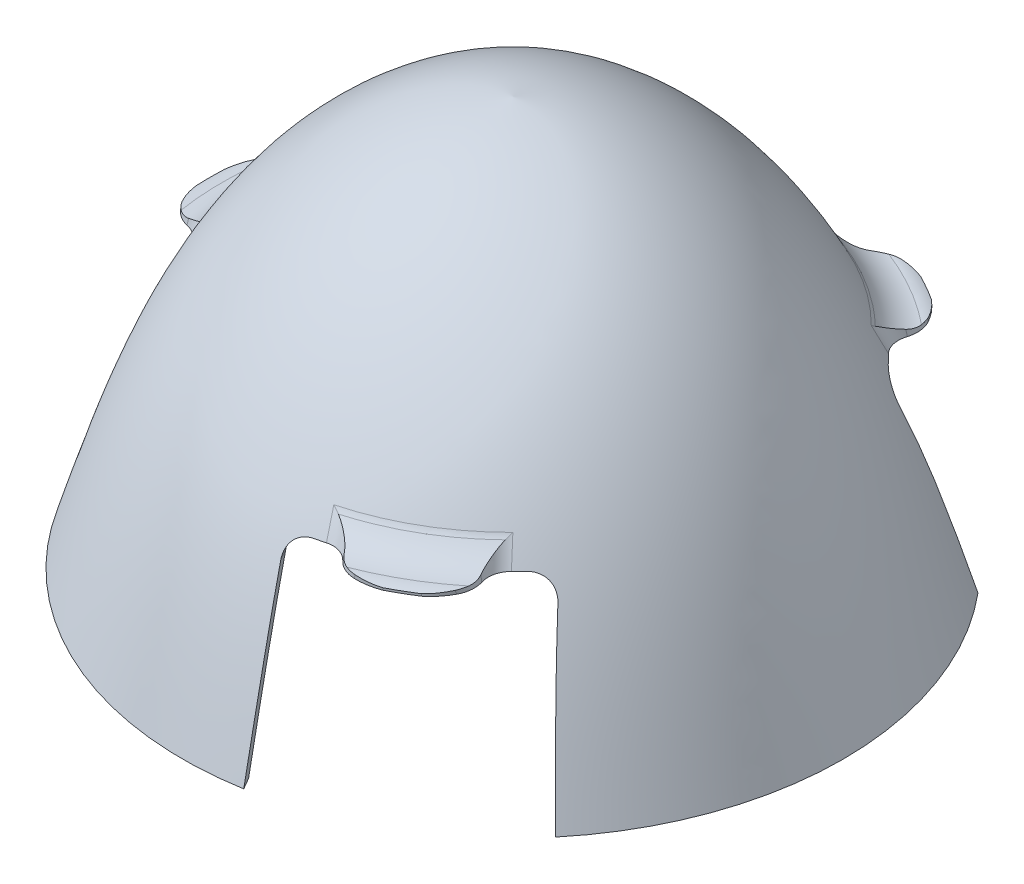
SolidWorks part; units mm, degrees
ref_plane "Face" through (0, 0, 0) normal (0, 0, 1) x (1, 0, 0)
ref_plane "Dessus" through (0, 0, 0) normal (0, 1, 0) x (1, 0, 0)
ref_plane "Droite" through (0, 0, 0) normal (1, 0, 0) x (0, 0, -1)
sketch "Esquisse1" plane through (0, 0, 0) normal (0, 0, 1) x (1, 0, 0)
  line L0 (0, 96.7594) -> (0, -88.7439) construction
  line L1 (-69.5, -71.5676) -> (0, -71.5676)
  line L2 (0, -71.5676) -> (0, 14.4324)
  point P6 (-48.9523, -19.4664)
  point P7 (-7.616, 13.2048)
  point P10 (-36.4902, -3.4927)
  dimension "D1" = 139
  dimension "D2" = 86
revolve "Révolution1" add sketch "Esquisse1" angle 360 about L0
shell "Coque1" thickness 2.5
sketch "Esquisse2" plane through (0, 0, 0) normal (1, 0, 0) x (0, 0, -1)
  line L0 (0, 0) -> (0, -78.7304) construction
  line L1 (-21.3551, -37.1841) -> (-24, -71.5676)
  line L2 (-16.3698, -32.5676) -> (16.3698, -32.5676)
  line L3 (-69.5, -71.5676) -> (69.5, -71.5676) construction
  line L4 (-24, -71.5676) -> (24, -71.5676)
  line L5 (21.3551, -37.1841) -> (24, -71.5676)
  arc A0 (-21.3551, -37.1841) -> (-16.3698, -32.5676) centre (-16.3698, -37.5676) cw
  arc A1 (21.3551, -37.1841) -> (16.3698, -32.5676) centre (16.3698, -37.5676) ccw
  point P8 (0, -32.5676)
  point P11 (-21, -32.5676)
  point P16 (0, -71.5676)
  dimension "D4" = 5
  dimension "D1" = 42
  dimension "D2" = 48
  dimension "D3" = 39
extrude "Enlèv. mat.-Extru.1" cut sketch "Esquisse2" against normal through all
sketch "Esquisse3" plane through (0, 0, 0) normal (0, 0, 1) x (1, 0, 0)
  line L0 (-55.6815, -32.5722) -> (-63.7414, -32.5722)
  line L1 (-53.0304, -26.9106) -> (-55.6815, -32.5722)
  line L2 (-63.7414, -32.5722) -> (-63.7414, -32.1124)
  line L3 (0.1414, -0.5023) -> (0.1414, -29.1715) construction
  arc A0 (-63.7414, -32.1124) -> (-61.1655, -31.7454) centre (-61.4473, -38.9905) cw
  arc A1 (-61.1655, -31.7454) -> (-53.0304, -26.9106) centre (-61.5615, -21.8176) ccw
revolve "Révolution3" add sketch "Esquisse3" angle 10 about L3
fillet "Congé2" radius 5
sketch "Esquisse8" plane through (0, -32.5722, 0) normal (0, -1, 0) x (1, 0, 0)
  line L0 (-50.7095, 0) -> (-68.4422, 0) construction
  line L1 (-62.7709, 11.0931) -> (-54.8334, 9.6936) construction
  line L2 (-59.6597, 10.5446) -> (-59.6597, 12.4952)
  line L3 (-59.6597, 12.4952) -> (-65.8108, 12.4952)
  line L4 (-65.8108, 12.4952) -> (-66.2017, 0)
  line L5 (-65.8108, -12.4952) -> (-66.2017, 0)
  line L6 (-59.6597, -12.4952) -> (-65.8108, -12.4952)
  line L7 (-59.6597, -10.5446) -> (-59.6597, -12.4952)
  arc A0 (-59.6597, 10.5446) -> (-63.8183, 0) centre (-50.522, 0.8485) ccw
  arc A1 (-59.6597, -10.5446) -> (-63.8183, 0) centre (-50.522, -0.8485) cw
extrude "Enlèv. mat.-Extru.2" cut sketch "Esquisse8" against normal through all
fillet "Congé15" radius 6
fillet "Congé16" radius 6
fillet "Congé3" radius 5
pattern_circular "Répétition circulaire1" count 3 every 120 about axis through (0, 96.7594, 0) along (0, -1, 0)
sketch "Esquisse5" plane through (0, 0, 0) normal (0, 0, 1) x (1, 0, 0)
  line L0 (64.3291, -62.8081) -> (62.2414, -63.5418)
  line L1 (62.0578, -63.9243) -> (62.1904, -64.3017)
  line L2 (62.5729, -64.4852) -> (64.625, -63.7641)
  line L3 (64.625, -63.7641) -> (64.3291, -62.8081)
  line L4 (0, -71.4535) -> (0, -56.3895) construction
  line L5 (0, 96.7594) -> (0, -88.7439) construction
  line L6 (52.0034, -71.5676) -> (66.8914, -71.5676) construction
  arc A0 (62.1904, -64.3017) -> (62.5729, -64.4852) centre (62.4735, -64.2022) ccw
  arc A1 (62.2414, -63.5418) -> (62.0578, -63.9243) centre (62.3408, -63.8248) ccw
  dimension "D1" = 0.3
  dimension "D3" = 2.2
  dimension "D4" = 1
revolve "Révolution4" add sketch "Esquisse5" angle 36 about L4
pattern_circular "Répétition circulaire2" count 3 every 120 about axis through (0, 96.7594, 0) along (0, -1, 0)
fillet "Congé9" [suppressed] radius 2
ref_plane "Plan1" through (0, 0, 0) normal (-0.5, 0, 0.866) x (0.866, 0, 0.5)
sketch "Esquisse7" plane through (0, 0, 0) normal (-0.5, 0, 0.866) x (0.866, 0, 0.5)
  line L0 (-66.9053, -71.5676) -> (-62.4756, -64.4852)
rib "Nervure3" sketch "Esquisse7" sketch "Esquisse7" thickness 1.5 extrusion direction parallel to sketch draft on no parameters "D1"=1.5
pattern_circular "Répétition circulaire18" count 6 every 12 about axis through (0, 96.7594, 0) along (0, -1, 0)
pattern_circular "Répétition circulaire19" count 3 every 120 about axis through (0, 96.7594, 0) along (0, -1, 0)
